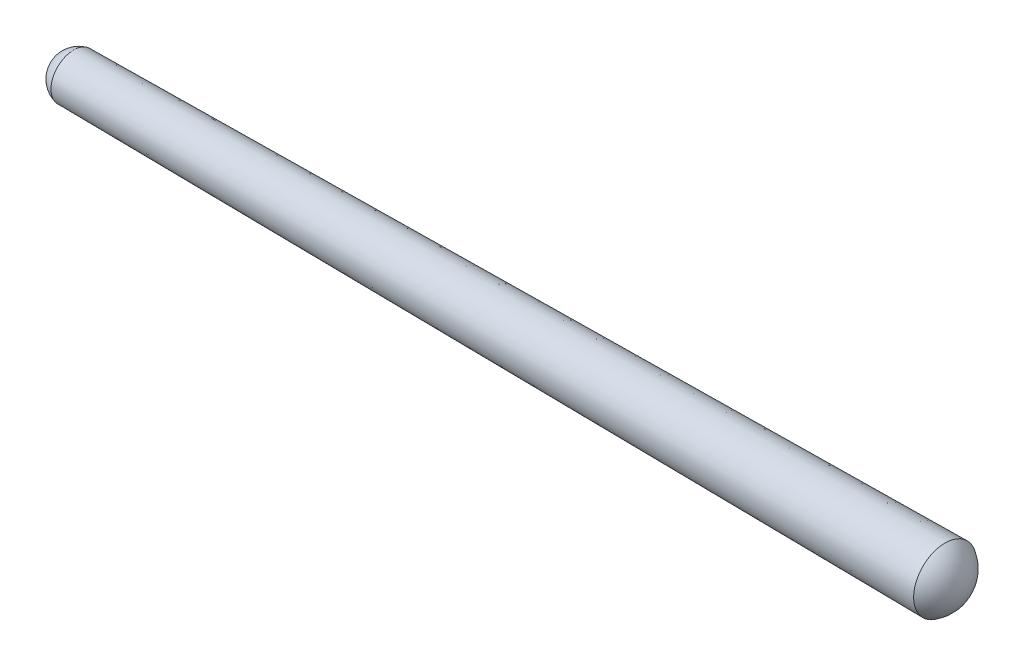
SolidWorks part; units mm, degrees
ref_plane "Plane1" through (0, 0, 0) normal (0, 0, 1) x (1, 0, 0)
ref_plane "Plane2" through (0, 0, 0) normal (0, 1, 0) x (1, 0, 0)
ref_plane "Plane3" through (0, 0, 0) normal (1, 0, 0) x (0, 0, -1)
revolve "Base-Revolve" add sketch "Sketch1" angle 360 about L0
sketch "Sketch1" plane through (0, 0, 0) normal (0, 0, 1) x (1, 0, 0)
  line L0 (0, 0) -> (210, 0) construction
  line L2 (0.8, 1) -> (39.2, 1.384)
  line L4 (0, 0) -> (40, 0)
  line L5 (0.8, -1) -> (39.2, -1.384) construction
  arc A0 (0.8, 1) -> (0, 0) centre (1.025, 0) ccw
  arc A1 (39.2, 1.384) -> (40, 0) centre (38.4028, 0) cw
  dimension "D1" = 0.8
  dimension "Diameter" = 2
  dimension "D2" = 0.573
  dimension "Length" = 40
  dimension "Crown_ht" = 0.8
equation "\"D1@Sketch1\" = \"Crown_ht@Sketch1\""
